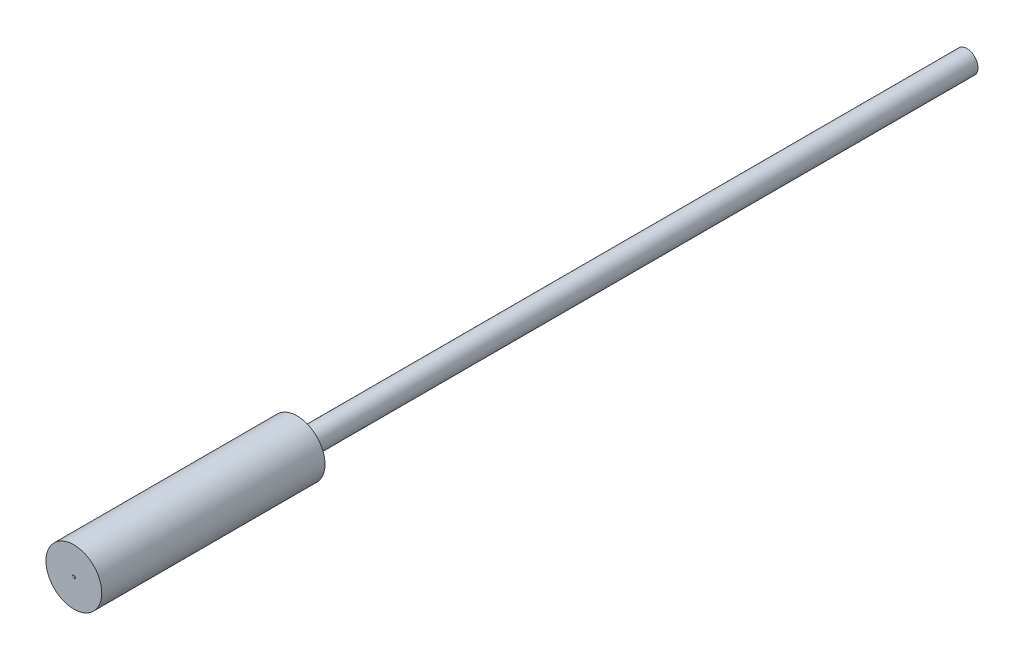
SolidWorks part; units mm, degrees
ref_plane "前视基准面" through (0, 0, 0) normal (0, 0, 1) x (1, 0, 0)
ref_plane "上视基准面" through (0, 0, 0) normal (0, 1, 0) x (1, 0, 0)
ref_plane "右视基准面" through (0, 0, 0) normal (1, 0, 0) x (0, 0, -1)
sketch "草图1" plane through (0, 0, 0) normal (0, 0, 1) x (1, 0, 0)
  circle A0 centre (0, 0) radius 1.25
  dimension "D1" = 2.5
extrude "凸台-拉伸1" add sketch "草图1" against normal blind 10
sketch "草图2" plane through (0, 0, -10) normal (0, 0, -1) x (-1, 0, 0)
  circle A0 centre (0, 0) radius 0.5
  dimension "D1" = 1
extrude "凸台-拉伸2" add sketch "草图2" along normal blind 30
sketch "草图3" plane through (0, 0, 0) normal (0, 0, 1) x (1, 0, 0)
  circle A0 centre (0, 0) radius 0.0625
  circle A1 centre (0, 0) radius 0.0675
  dimension "D1" = 0.135
  dimension "D2" = 0.125
extrude "切除-拉伸1" cut sketch "草图3" against normal blind 0.1
